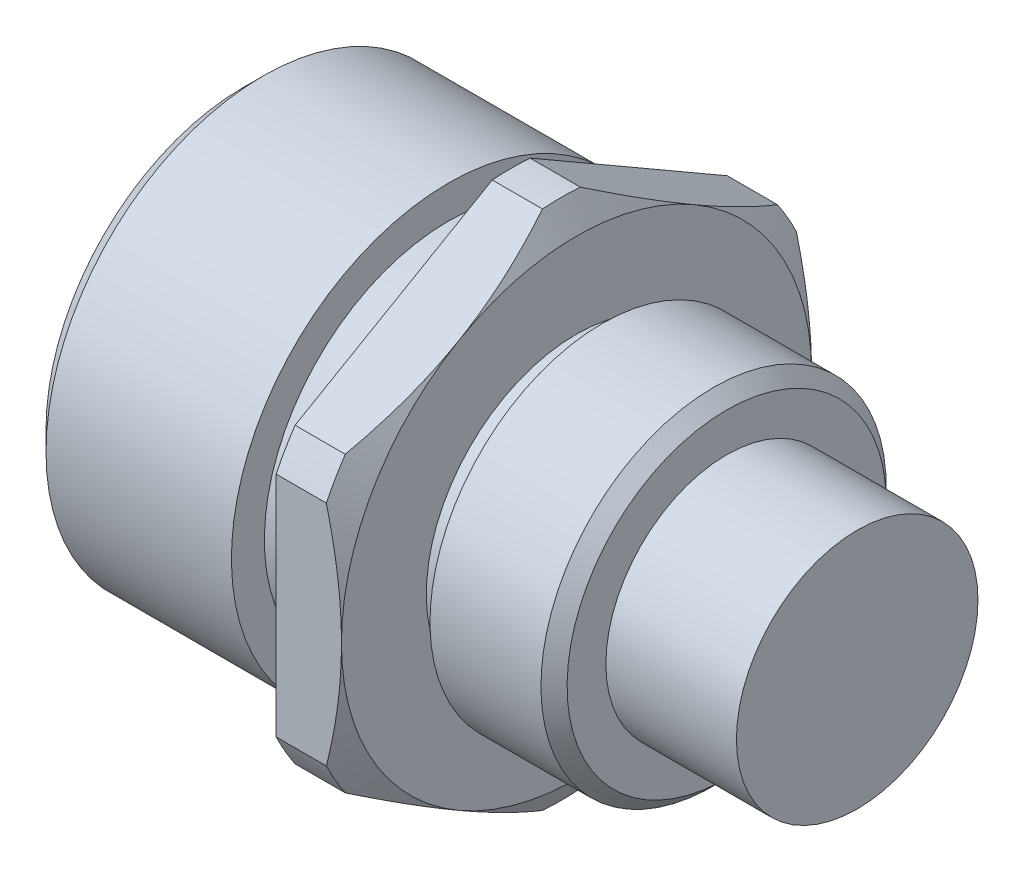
SolidWorks part; units mm, degrees
ref_plane "Face" through (0, 0, 0) normal (0, 0, 1) x (1, 0, 0)
ref_plane "Dessus" through (0, 0, 0) normal (0, 1, 0) x (1, 0, 0)
ref_plane "Droite" through (0, 0, 0) normal (1, 0, 0) x (0, 0, -1)
imported_body "Importée1"
sketch "Esquisse1" plane through (0, 0, 0) normal (1, 0, 0) x (0, 0, -1)
  circle A0 centre (0, 0) radius 9.25
  dimension "D1" = 18.5
extrude "Extrusion1" add sketch "Esquisse1" along normal blind 10
